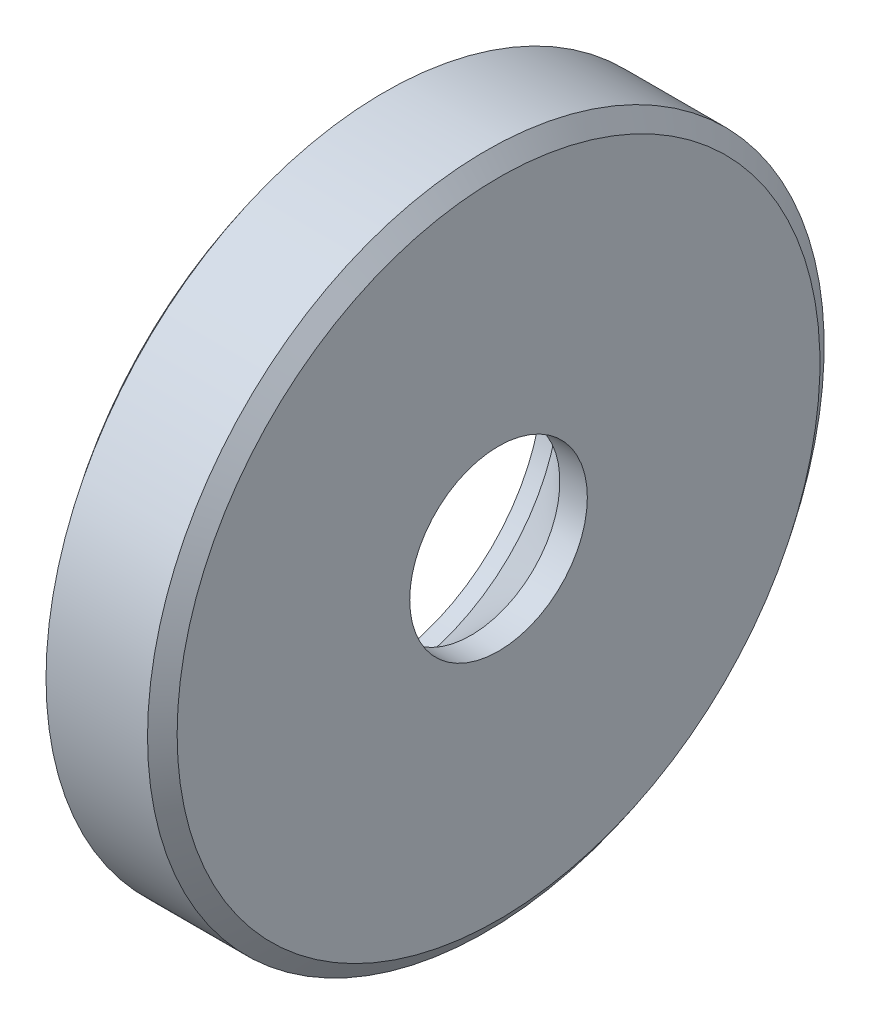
SolidWorks part; units mm, degrees
ref_plane "Face" through (0, 0, 0) normal (0, 0, 1) x (1, 0, 0)
ref_plane "Dessus" through (0, 0, 0) normal (0, 1, 0) x (1, 0, 0)
ref_plane "Droite" through (0, 0, 0) normal (1, 0, 0) x (0, 0, -1)
imported_body "Importée1"
ref_plane "Plan1" through (-147.6, 0, 0) normal (-1, 0, 0) x (0, 0, 1)
sketch "Esquisse1" plane through (-147.6, 0, 0) normal (-1, 0, 0) x (0, 0, 1)
  circle A0 centre (184, 112) radius 4.05 construction
  circle A1 centre (184, 112) radius 4.05
extrude "Enlèv. mat.-Extru.2" cut sketch "Esquisse1" against normal blind 10 draft 45 and the other way through all
